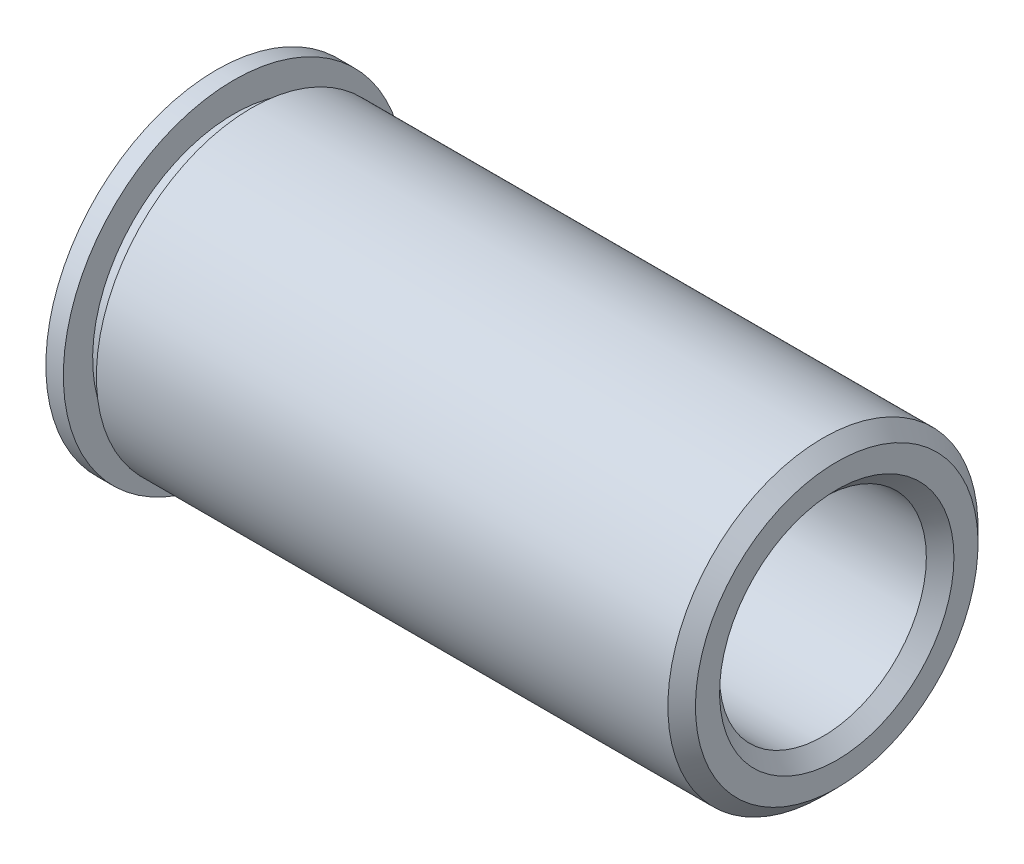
SolidWorks part; units mm, degrees
ref_plane "Front Plane" through (0, 0, 0) normal (0, 0, 1) x (1, 0, 0)
ref_plane "Top Plane" through (0, 0, 0) normal (0, 1, 0) x (1, 0, 0)
ref_plane "Right Plane" through (0, 0, 0) normal (1, 0, 0) x (0, 0, -1)
sketch "Sketch1" plane through (0, 0, 0) normal (0, 0, 1) x (1, 0, 0)
  line L0 (-67.8249, 0) -> (78.2137, 0) construction
  line L1 (78.2137, 0) -> (78.2137, 2.25)
  line L2 (78.2137, 2.25) -> (69.7217, 2.25)
  line L3 (69.7217, 2.25) -> (69.7217, 2.05)
  line L4 (69.7217, 2.05) -> (69.4677, 2.05)
  line L5 (69.4677, 2.05) -> (69.4677, 2.475)
  line L6 (69.4677, 2.475) -> (69.2137, 2.475)
  line L7 (69.2137, 2.475) -> (69.2137, 0)
  line L8 (69.2137, 0) -> (78.2137, 0)
  dimension "D1" = 2.25
  dimension "D2" = 9
  dimension "D3" = 0.254
  dimension "D4" = 0.254
  dimension "D5" = 0.2
  dimension "D6" = 2.475
revolve "Revolve1" add sketch "Sketch1" angle 360 about L0
sketch "Sketch2" plane through (78.2137, 0, 0) normal (1, 0, 0) x (0, 0, -1)
  circle A0 centre (0, 0) radius 1.5
  dimension "D1" = 3
extrude "Cut-Extrude1" cut sketch "Sketch2" against normal through all contours A0
chamfer "Chamfer1" distance 0.2 angle 45 1 edges at (78.2137, -2.25, 0)
chamfer "Chamfer2" distance 0.2 angle 45 2 edges at (69.2137, 0, -1.5) (78.2137, 0, -1.5)
